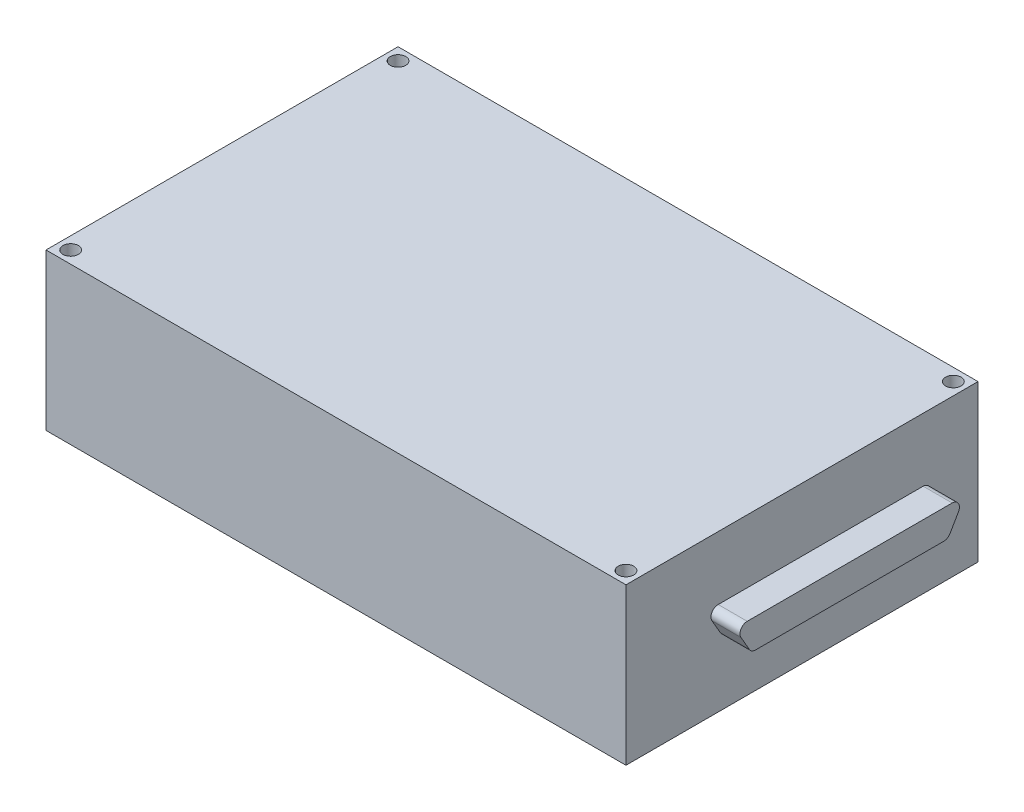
SolidWorks part; units mm, degrees
ref_plane "Front Plane" through (0, 0, 0) normal (0, 0, 1) x (1, 0, 0)
ref_plane "Top Plane" through (0, 0, 0) normal (0, 1, 0) x (1, 0, 0)
ref_plane "Right Plane" through (0, 0, 0) normal (1, 0, 0) x (0, 0, -1)
sketch "Sketch1" plane through (0, 0, 0) normal (0, 1, 0) x (1, 0, 0)
  line L1 (-50.8, -30.8356) -> (50.8, -30.8356)
  line L2 (-50.8, -30.8356) -> (-50.8, 30.8356)
  line L3 (-50.8, 30.8356) -> (50.8, 30.8356)
  line L4 (50.8, -30.8356) -> (50.8, 30.8356)
  line L5 (-50.8, -30.8356) -> (50.8, 30.8356) construction
  line L6 (-50.8, 30.8356) -> (50.8, -30.8356) construction
  point P0 (0, 0)
  dimension "D1" = 61.6712
  dimension "D2" = 101.6
extrude "Boss-Extrude1" add sketch "Sketch1" along normal mid plane 27.3812
sketch "Sketch2" plane through (50.8, 0, 0) normal (1, 0, 0) x (0, 0, -1)
  line L0 (3.2766, 2.6162) -> (3.2766, -2.4638) construction
  line L1 (-13.2071, -2.4638) -> (19.7603, -2.4638)
  line L2 (3.2766, 0.0762) -> (-12.8946, 0.0762) construction
  line L3 (-14.6735, 2.6162) -> (21.2267, 2.6162)
  line L4 (-30.8356, -13.6906) -> (30.8356, -13.6906) construction
  line L5 (-30.8356, 13.6906) -> (-30.8356, -13.6906) construction
  line L6 (-15.7734, 0.7112) -> (-14.3069, -1.8288)
  line L7 (22.3266, 0.7112) -> (20.8601, -1.8288)
  arc A0 (21.2267, 2.6162) -> (22.3266, 0.7112) centre (21.2267, 1.3462) cw
  arc A1 (19.7603, -2.4638) -> (20.8601, -1.8288) centre (19.7603, -1.1938) ccw
  arc A2 (-14.3069, -1.8288) -> (-13.2071, -2.4638) centre (-13.2071, -1.1938) ccw
  arc A3 (-15.7734, 0.7112) -> (-14.6735, 2.6162) centre (-14.6735, 1.3462) cw
  point P10 (23.4265, 2.6162)
  point P13 (20.4935, -2.4638)
  point P16 (-13.9403, -2.4638)
  point P19 (-16.8733, 2.6162)
  dimension "D4" = 1.27
  dimension "D1" = 34.1122
  dimension "D2" = 5.08
  dimension "D3" = 60
  dimension "D5" = 13.7668
  dimension "D6" = 38.1
extrude "Boss-Extrude2" add sketch "Sketch2" along normal blind 5.08
sketch "Sketch3" plane through (-50.8, 0, 0) normal (-1, 0, 0) x (0, 0, 1)
  line L0 (-30.8356, -13.6906) -> (30.8356, -13.6906) construction
  line L1 (-30.8356, 13.6906) -> (-30.8356, -13.6906) construction
  circle A0 centre (-12.0904, -1.9304) radius 5.08
  dimension "D2" = 10.16
  dimension "D1" = 11.7602
  dimension "D3" = 18.7452
extrude "Boss-Extrude3" add sketch "Sketch3" along normal blind 5.08
sketch "Sketch4" plane through (-50.8, 0, 0) normal (-1, 0, 0) x (0, 0, 1)
  line L0 (-30.8356, 13.6906) -> (-30.8356, -13.6906) construction
  line L1 (-30.8356, -13.6906) -> (30.8356, -13.6906) construction
  circle A0 centre (22.5298, 2.1336) radius 1.905
  dimension "D3" = 3.81
  dimension "D1" = 53.3654
  dimension "D2" = 15.8242
extrude "Boss-Extrude4" add sketch "Sketch4" along normal blind 3.81
hole_wizard "#6-32 Tapped Hole1" positions "Sketch7" profile "Sketch6" tap size "#6-32" standard "ANSI Inch"
sketch "Sketch7" plane through (0, 13.6906, 0) normal (0, 1, 0) x (1, 0, 0)
  line L1 (48.641, -28.6766) -> (-48.641, -28.6766) construction
  line L2 (48.641, -28.6766) -> (48.641, 28.6766) construction
  line L3 (48.641, 28.6766) -> (-48.641, 28.6766) construction
  line L4 (-48.641, -28.6766) -> (-48.641, 28.6766) construction
  line L5 (50.8, 30.8356) -> (-50.8, 30.8356) construction
  line L6 (50.8, -30.8356) -> (50.8, 30.8356) construction
  point P0 (48.641, -28.6766)
  point P1 (-48.641, 28.6766)
  point P4 (48.641, 28.6766)
  point P5 (-48.641, -28.6766)
  dimension "D1" = 97.282
  dimension "D2" = 57.3532
  dimension "D3" = 2.159
  dimension "D4" = 2.159
sketch "Sketch6" plane through (48.641, 13.6906, 28.6766) normal (1, 0, 0) x (0, 0, 1)
  line L0 (0, 0) -> (0, 7.1627)
  line L1 (0, 7.1627) -> (1.3525, 6.35)
  line L2 (1.3525, 6.35) -> (1.3525, 0)
  line L5 (1.3525, 0) -> (0, 0)
  line L10 (0, 7.1627) -> (-1.3526, 6.35) construction
  line L11 (0, -6.35) -> (0, 107.95) construction
  dimension "Tap Drill Dia." = 2.7051
  dimension "Tap Drill Depth" = 6.35
  dimension "Drill Angle" = 118
